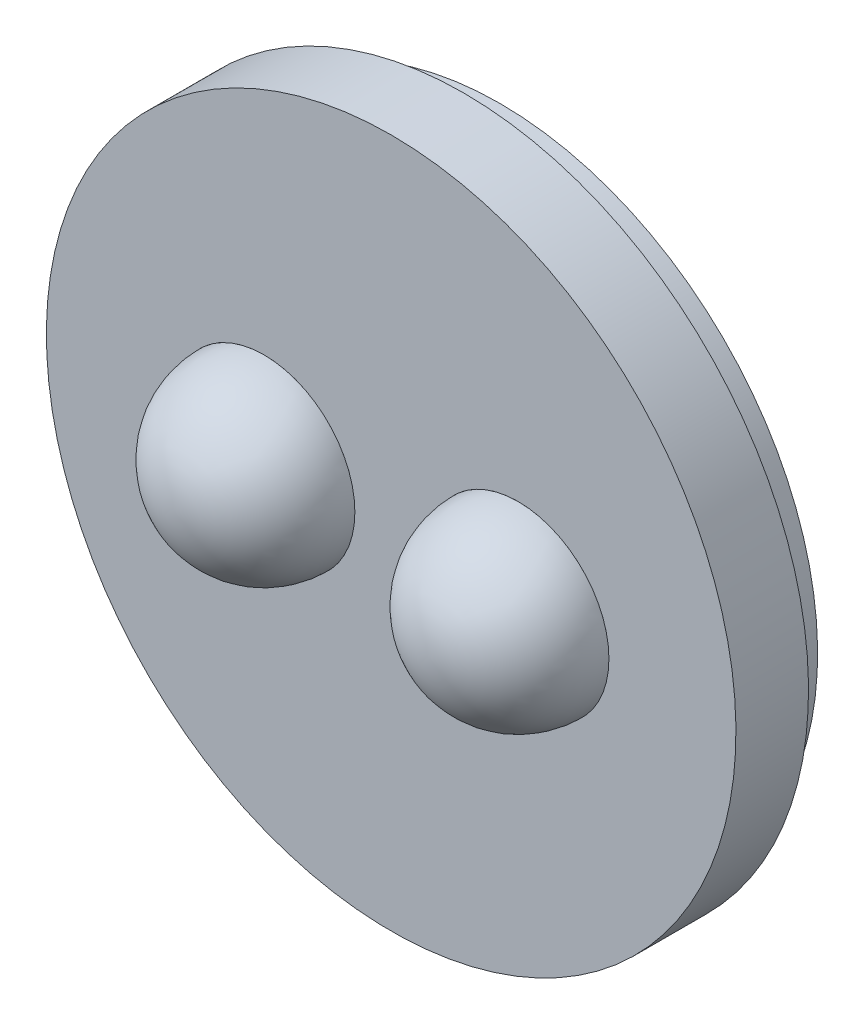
SolidWorks part; units mm, degrees
ref_plane "Front Plane" through (0, 0, 0) normal (0, 0, 1) x (1, 0, 0)
ref_plane "Top Plane" through (0, 0, 0) normal (0, 1, 0) x (1, 0, 0)
ref_plane "Right Plane" through (0, 0, 0) normal (1, 0, 0) x (0, 0, -1)
sketch "Sketch1" plane through (0, 0, 0) normal (1, 0, 0) x (0, 0, -1)
  line L0 (0, 0) -> (0, 120.65)
  line L1 (0, 120.65) -> (25.4, 120.65)
  line L2 (25.4, 120.65) -> (25.4, 111.125)
  line L3 (25.4, 111.125) -> (38.1, 111.125)
  line L4 (38.1, 111.125) -> (38.1, 0)
  line L5 (38.1, 0) -> (0, 0)
  dimension "D1" = 120.65
  dimension "D2" = 38.1
  dimension "D3" = 25.4
  dimension "D4" = 9.525
revolve "Revolve1" add sketch "Sketch1" angle 360 about L5
sketch "Sketch2" plane through (0, 0, 0) normal (0, 0, 1) x (1, 0, 0)
  line L1 (-44.45, 0) -> (44.45, 0) construction
  circle A1 centre (44.45, 0) radius 31.75
  circle A2 centre (-44.45, 0) radius 31.75
  point P0 (0, 0)
  point P1 (0, 0)
  dimension "D2" = 63.5
  dimension "D1" = 88.9
extrude "Cut-Extrude1" cut sketch "Sketch2" against normal through all
sketch "Sketch4" plane through (0, 0, 0) normal (0, 0, 1) x (1, 0, 0)
  line L0 (-44.45, 31.75) -> (-44.45, -31.75) construction
  line L1 (44.45, 31.75) -> (44.45, -31.75) construction
  line L2 (0, 19.5764) -> (0, 83.0764) construction
  circle A0 centre (-44.45, 0) radius 31.75 construction
  circle A3 centre (44.45, 0) radius 31.75 construction
ref_plane "Plane1" through (44.45, 0, 0) normal (1, 0, 0) x (0, 0, -1)
ref_plane "Plane2" through (-44.45, 0, 0) normal (1, 0, 0) x (0, 0, -1)
sketch "Sketch5" plane through (-44.45, 0, 0) normal (1, 0, 0) x (0, 0, -1)
  line L0 (0, 0) -> (-31.75, 0)
  line L1 (0, 31.75) -> (0, -31.75) construction
  line L2 (0, 120.65) -> (0, -120.65) construction
  line L3 (0, 0) -> (0, -31.75)
  arc A0 (-31.75, 0) -> (0, -31.75) centre (0, 0) ccw
revolve "Revolve2" add sketch "Sketch5" angle 360 about L0
sketch "Sketch6" plane through (44.45, 0, 0) normal (1, 0, 0) x (0, 0, -1)
  line L0 (0, 31.75) -> (0, -31.75) construction
  line L1 (0, 0) -> (-31.75, 0) construction
  line L2 (0, 0) -> (0, -31.75)
  line L3 (0, 0) -> (-31.75, 0)
  arc A0 (-31.75, 0) -> (0, -31.75) centre (0, 0) ccw construction
  arc A1 (-31.75, 0) -> (0, -31.75) centre (0, 0) ccw
revolve "Revolve3" add sketch "Sketch6" angle 360 about L3
sketch "Sketch7" plane through (0, 0, 0) normal (1, 0, 0) x (0, 0, -1)
  line L0 (0, 19.5764) -> (0, 83.0764) construction
  line L2 (0, 51.3264) -> (0, 19.5764)
  line L3 (0, 51.3264) -> (-31.75, 51.3264)
  arc A1 (-31.75, 51.3264) -> (0, 19.5764) centre (0, 51.3264) ccw
